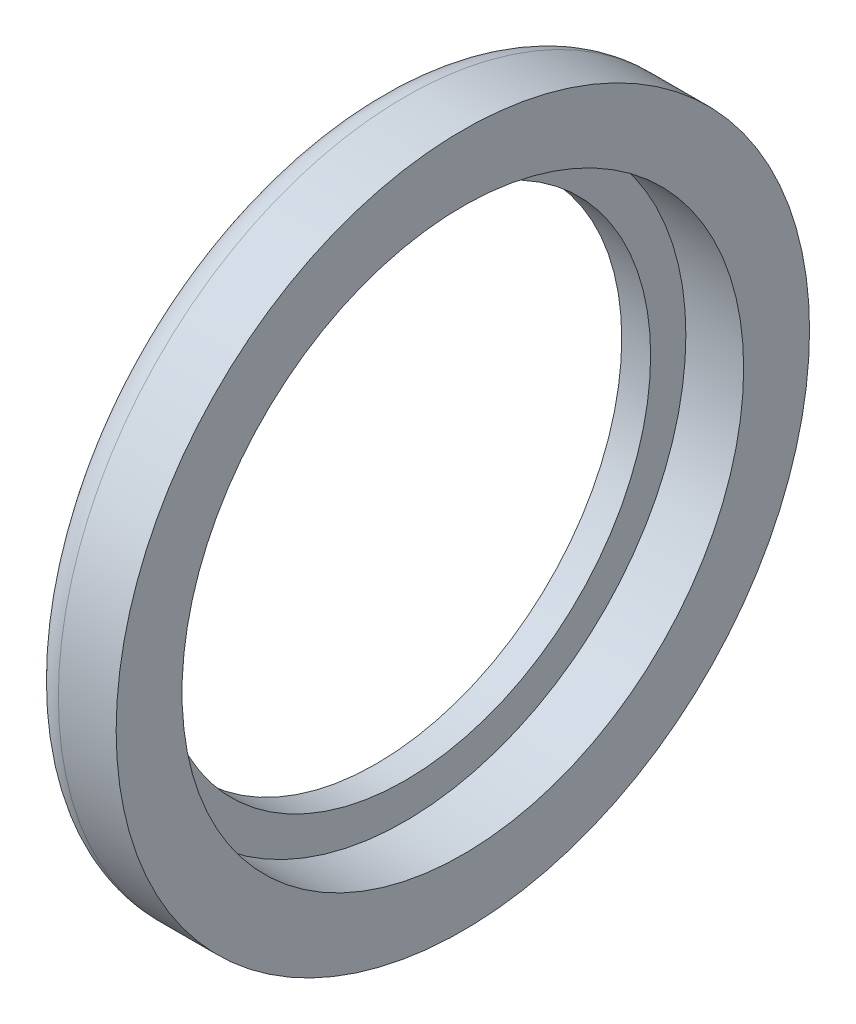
SolidWorks part; units mm, degrees
ref_plane "Front" through (0, 0, 0) normal (0, 0, 1) x (1, 0, 0)
ref_plane "Top" through (0, 0, 0) normal (0, 1, 0) x (1, 0, 0)
ref_plane "Right" through (0, 0, 0) normal (1, 0, 0) x (0, 0, -1)
sketch "Sketch1" plane through (0, 0, 0) normal (0, 0, 1) x (1, 0, 0)
  line L0 (0, 38.1) -> (-9.525, 38.1)
  line L1 (-9.525, 38.1) -> (-9.525, 26.9875)
  line L2 (-9.525, 26.9875) -> (-6.35, 26.9875)
  line L3 (-6.35, 26.9875) -> (-6.35, 30.861)
  line L4 (-6.35, 30.861) -> (0, 30.861)
  line L5 (0, 30.861) -> (0, 38.1)
  line L6 (0, 30.861) -> (0, 0) construction
  line L7 (0, 0) -> (-9.525, 0) construction
  dimension "D1" = 38.1
  dimension "D2" = 9.525
  dimension "D3" = 6.35
  dimension "D4" = 26.9875
  dimension "D5" = 30.861
revolve "Revolve1" add sketch "Sketch1" angle 360 about L7
fillet "Fillet1" radius 3.175 1 edges at (-9.525, 0, -38.1)
